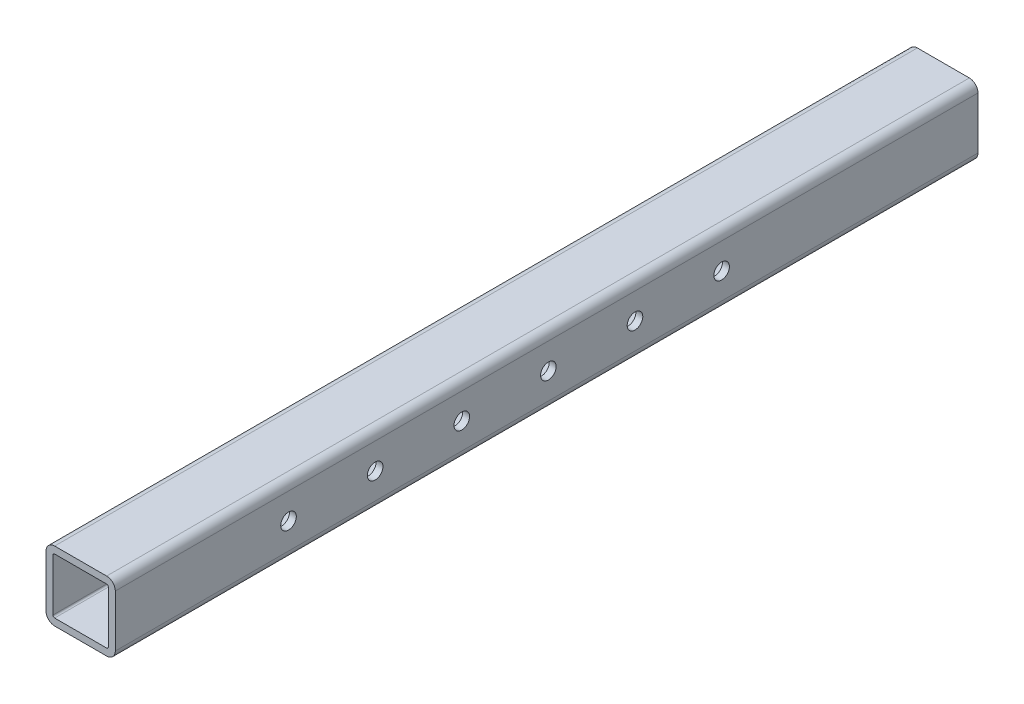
SolidWorks part; units mm, degrees
ref_plane "Face" through (0, 0, 0) normal (0, 0, 1) x (1, 0, 0)
ref_plane "Dessus" through (0, 0, 0) normal (0, 1, 0) x (1, 0, 0)
ref_plane "Droite" through (0, 0, 0) normal (1, 0, 0) x (0, 0, -1)
sketch "Esquisse1" plane through (0, 0, 0) normal (0, 0, 1) x (1, 0, 0)
  line L0 (5, -4) -> (35, -4)
  line L1 (5, 0) -> (35, 0)
  line L2 (0, -5) -> (0, -35)
  line L3 (5, -40) -> (35, -40)
  line L4 (40, -5) -> (40, -35)
  line L5 (36, -5) -> (36, -35)
  line L6 (5, -36) -> (35, -36)
  line L7 (4, -5) -> (4, -35)
  arc A0 (40, -5) -> (35, 0) centre (35, -5) ccw
  arc A1 (35, -40) -> (40, -35) centre (35, -35) ccw
  arc A2 (0, -35) -> (5, -40) centre (5, -35) ccw
  arc A3 (5, 0) -> (0, -5) centre (5, -5) ccw
  arc A4 (36, -5) -> (35, -4) centre (35, -5) ccw
  arc A5 (35, -36) -> (36, -35) centre (35, -35) ccw
  arc A6 (4, -35) -> (5, -36) centre (5, -35) ccw
  arc A7 (5, -4) -> (4, -5) centre (5, -5) ccw
  point P7 (40, 0)
  point P12 (0, -40)
  point P15 (0, 0)
  dimension "D3" = 5
  dimension "D1" = 40
  dimension "D2" = 40
  dimension "D4" = 4
extrude "Base-Extrusion" add sketch "Esquisse1" along normal blind 498
sketch "Esquisse2" plane through (0, 0, 0) normal (-1, 0, 0) x (0, 0, 1)
  line L0 (498, -40) -> (0, -40) construction
  line L1 (498, -5) -> (498, -35) construction
  circle A0 centre (398, -20) radius 4.5
  circle A1 centre (348, -20) radius 4.5
  circle A2 centre (298, -20) radius 4.5
  circle A3 centre (248, -20) radius 4.5
  circle A4 centre (198, -20) radius 4.5
  circle A5 centre (148, -20) radius 4.5
  dimension "D1" = 9
  dimension "D2" = 20
  dimension "D3" = 100
  dimension "D4" = 50
  dimension "D5" = 50
  dimension "D6" = 50
  dimension "D7" = 50
  dimension "D8" = 50
extrude "Enlèv. mat.-Extru.1" cut sketch "Esquisse2" against normal through all
